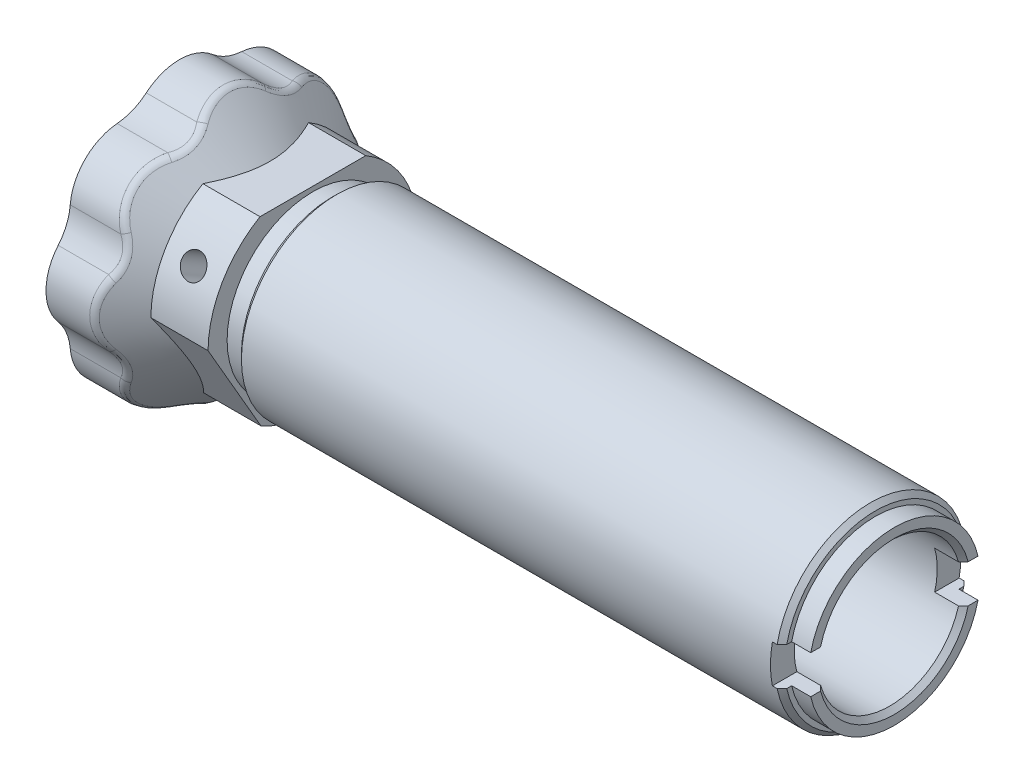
SolidWorks part; units mm, degrees
ref_plane "Front Plane" through (0, 0, 0) normal (0, 0, 1) x (1, 0, 0)
ref_plane "Top Plane" through (0, 0, 0) normal (0, 1, 0) x (1, 0, 0)
ref_plane "Right Plane" through (0, 0, 0) normal (1, 0, 0) x (0, 0, -1)
sketch "Sketch1" plane through (0, 0, 0) normal (0, 0, 1) x (1, 0, 0)
  line L0 (0, 0) -> (-111.8248, 0) construction
  line L1 (-0.5, 7.5) -> (0, 8)
  line L2 (0, 8) -> (0, 9)
  line L3 (0, 9) -> (-2, 9)
  line L4 (-2, 9) -> (-2, 10)
  line L5 (-2, 10) -> (-59, 10)
  line L7 (-61, 11) -> (-67, 11)
  line L8 (-67, 11) -> (-70, 14)
  line L9 (-70, 14) -> (-75, 14)
  line L10 (-75, 14) -> (-75, 10.5)
  line L11 (-75, 10.5) -> (-69, 10.5)
  line L12 (-69, 10.5) -> (-69, 7.5)
  line L13 (-69, 7.5) -> (-0.5, 7.5)
  line L16 (-59, 10) -> (-59, 9)
  line L17 (-59, 9) -> (-61, 9)
  line L18 (-61, 11) -> (-61, 9)
  dimension "D1" = 75
  dimension "D2" = 6.5
  dimension "D3" = 2.5
  dimension "D4" = 3.5
  dimension "D5" = 1
  dimension "D6" = 2
  dimension "D7" = 15
  dimension "D8" = 0.5
  dimension "D9" = 45
  dimension "D10" = 2
  dimension "D11" = 5
  dimension "D12" = 6
  dimension "D13" = 3.5
  dimension "D14" = 1.5
  dimension "D15" = 6
revolve "Revolve1" add sketch "Sketch1" angle 360 about L0
sketch "Sketch2" plane through (-75, 0, 0) normal (-1, 0, 0) x (0, 0, 1)
  arc A1 (3.4835, 12.7199) -> (-3.4835, 12.7199) centre (0, 8.6201) ccw
  circle A4 centre (0, 0) radius 14 construction
  arc A5 (11.4576, 6.5311) -> (6.5311, 11.4576) centre (6.0953, 6.0953) ccw
  arc A6 (12.7199, -3.4835) -> (12.7199, 3.4835) centre (8.6201, 0) ccw
  arc A7 (6.5311, -11.4576) -> (11.4576, -6.5311) centre (6.0953, -6.0953) ccw
  arc A8 (-3.4835, -12.7199) -> (3.4835, -12.7199) centre (0, -8.6201) ccw
  arc A9 (-11.4576, -6.5311) -> (-6.5311, -11.4576) centre (-6.0953, -6.0953) ccw
  arc A10 (-12.7199, 3.4835) -> (-12.7199, -3.4835) centre (-8.6201, 0) ccw
  arc A11 (-6.5311, 11.4576) -> (-11.4576, 6.5311) centre (-6.0953, 6.0953) ccw
  arc A12 (-6.5311, 11.4576) -> (-3.4835, 12.7199) centre (-6.967, 16.8198) ccw
  arc A13 (3.4835, 12.7199) -> (6.5311, 11.4576) centre (6.967, 16.8198) ccw
  arc A14 (11.4576, 6.5311) -> (12.7199, 3.4835) centre (16.8198, 6.967) ccw
  arc A15 (12.7199, -3.4835) -> (11.4576, -6.5311) centre (16.8198, -6.967) ccw
  arc A16 (6.5311, -11.4576) -> (3.4835, -12.7199) centre (6.967, -16.8198) ccw
  arc A17 (-3.4835, -12.7199) -> (-6.5311, -11.4576) centre (-6.967, -16.8198) ccw
  arc A18 (-11.4576, -6.5311) -> (-12.7199, -3.4835) centre (-16.8198, -6.967) ccw
  arc A19 (-12.7199, 3.4835) -> (-11.4576, 6.5311) centre (-16.8198, 6.967) ccw
  circle A20 centre (0, 0) radius 8.6201 construction
  circle A21 centre (0, 0) radius 19.6277
  dimension "D1" = 17.2401
  dimension "D2" = 8
  dimension "D3" = 8
extrude "Cut-Extrude1" cut sketch "Sketch2" against normal through all
chamfer "Chamfer1" distance 0.5 angle 45 2 edges at (-59, 0, -10) (-2, 0, -10)
sketch "Sketch6" plane through (0, 0, 0) normal (0, 0, 1) x (1, 0, 0)
  line L0 (0, -9) -> (0, 9) construction
  line L1 (-3, 2) -> (0, 2)
  line L2 (-3, 2) -> (-3, -2)
  line L3 (-3, -2) -> (0, -2)
  line L4 (0, 2) -> (0, -2)
  dimension "D1" = 3
  dimension "D2" = 4
extrude "Cut-Extrude3" cut sketch "Sketch6" against normal through all both and the other way through all
sketch "Sketch7" plane through (-61, 0, 0) normal (1, 0, 0) x (0, 0, -1)
  line L0 (0, 14.5) -> (0, 0) construction
  line L1 (-7.5, 14.5) -> (7.5, 14.5)
  line L2 (-7.5, 14.5) -> (-7.5, 9.5)
  line L3 (-7.5, 9.5) -> (7.5, 9.5)
  line L4 (7.5, 14.5) -> (7.5, 9.5)
  circle A2 centre (0, 0) radius 9 construction
  dimension "D1" = 0.5
  dimension "D2" = 5
  dimension "D3" = 15
extrude "Cut-Extrude4" cut sketch "Sketch7" against normal up to surface (11.3248 mm away)
pattern_circular "CirPattern1" count 3 over 360 about axis through (0, 0, 0) along (1, 0, 0) of "Cut-Extrude4"
hole_wizard "Ø2.5 (2.5) Diameter Hole1" positions "3DSketch1" profile "Sketch8" hole size "Ø2.5" standard "ANSI Metric"
sketch3d "3DSketch1"
  line L0 (-61, 5.5, 9.5263) -> (-67, 5.5, 9.5263) construction
  line L1 (-61, 5.5, 9.5263) -> (-61, 9.5, 5.5453) construction
  line L2 (-61, 5.5, 9.5263) -> (-61, 0.0523, 10.9999) construction
  arc A2 (-61, 9.5, 5.5453) -> (-61, 0.0523, 10.9999) centre (-61, 0, 0) ccw construction
  point P0 (-64, 5.5, 9.5263)
  point P2 (-64, 5.5, -9.5263)
  point P4 (-64, -11, 0)
  point P31 (-50, 0, 0)
  dimension "D2" = 3
  dimension "D1" = 3
sketch "Sketch8" plane through (-64, 5.5, 9.5263) normal (1, 0, 0) x (0, -0.866, 0.5)
  line L0 (0, 0) -> (0, 3.5)
  line L1 (0, 3.5) -> (1.25, 3.5)
  line L2 (1.25, 3.5) -> (1.25, 0)
  line L5 (1.25, 0) -> (0, 0)
  line L11 (0, -6.35) -> (0, 107.95) construction
  dimension "Thru Hole Dia." = 2.5
  dimension "Thru Hole Depth" = 3.5
chamfer "Chamfer2" distance 0.5 angle 45 2 edges at (-69, 0, -7.5) (-75, 0, -10.5)
fillet "Fillet1" radius 1 16 edges at (-69.9865, 13.9781, -0.4849) (-68.8688, 11.6589, -5.4475) (-69.9865, 9.5412, -10.2269) (-68.8688, 4.3921, -12.0961) (-69.9865, -0.4849, -13.9781) (-68.8688, -5.4475, -11.6589) (-69.9865, -10.2269, -9.5412) (-68.8688, -12.0961, -4.3921) (-69.9865, -13.9781, 0.4849) (-68.8688, -11.6589, 5.4475) (-69.9865, -9.5412, 10.2269) (-68.8688, -4.3921, 12.0961) (-69.9865, 0.4849, 13.9781) (-68.8688, 5.4475, 11.6589) (-69.9865, 10.2269, 9.5412) (-68.8688, 12.0961, 4.3921)
thread "Thread1" pitch 1.5 start angle 0, offset 2, length 0, pitch 1.5, diameter 20
ref_plane "Plane1" through (-0.5, 0, 10) normal (0, -1, 0) x (0, 0, 1)
sketch "Thread Profile1" plane through (-0.5, 0, 10) normal (0, -1, 0) x (0, 0, 1)
  line L0 (0, 0) -> (0, 1.5) construction
  line L11 (0, 0) -> (0, 1.3125)
  line L12 (0, 1.3125) -> (-0.8119, 0.8437)
  line L13 (-0.8119, 0.8437) -> (-0.8119, 0.4687)
  line L15 (-0.8119, 0.4687) -> (0, 0)
  line L17 (-0.8119, 0.6562) -> (0, 0.6562) construction
  point P2 (0, 0)
  dimension "Pitch" = 1.5
  dimension "Profile_Angle" = 60
  dimension "Profile_Land" = 0.375
  dimension "Profile_Height" = 0.8119
sketch3d "CAMWorksSketchPoint"
  point P0 (-260.1, -143.3887, -337)
  point P1 (877, 265, 300)
sketch "Screw_Sketch" plane through (0, 0, 0) normal (0, 0, 1) x (1, 0, 0)
  line L0 (-59, 10) -> (-59, 0)
  line L1 (-59, 0) -> (0, 0)
  line L3 (-18, 10) -> (-37.5, 10)
  line L5 (-37.5, 10) -> (-59, 10)
  line L6 (-20, 0) -> (-20, 17.4273) construction
  line L7 (-40, 0) -> (-40, 17.4273) construction
  line L8 (-60, 0) -> (-60, 17.4273) construction
  line L9 (0, 2) -> (0, 9) construction
  line L10 (0, 0) -> (0, 10)
  line L15 (-59, 10) -> (-59, 9)
  line L16 (-59, 9) -> (-61, 9)
  line L17 (-61, 9) -> (-61, 11)
  line L18 (-61, 11) -> (-67, 11)
  line L19 (-67, 11) -> (-70, 14)
  line L20 (-70, 14) -> (-75, 14)
  line L21 (-75, 14) -> (-75, 10.5)
  line L22 (-75, 10.5) -> (-69, 10.5)
  line L23 (-69, 10.5) -> (-69, 7.5)
  line L24 (-69, 7.5) -> (-0.5, 7.5)
  line L25 (-0.5, 7.5) -> (0, 8)
  line L26 (0, 8) -> (0, 9)
  line L27 (0, 9) -> (-2, 9)
  line L28 (-2, 9) -> (-2, 10)
  line L29 (-2, 10) -> (-59, 10)
  line L44 (0, 10) -> (-18, 10)
  dimension "D2" = 18
  dimension "D3" = 37.5
  dimension "D5" = 20
  dimension "D6" = 40
  dimension "D7" = 60
  dimension "D1" = 0
